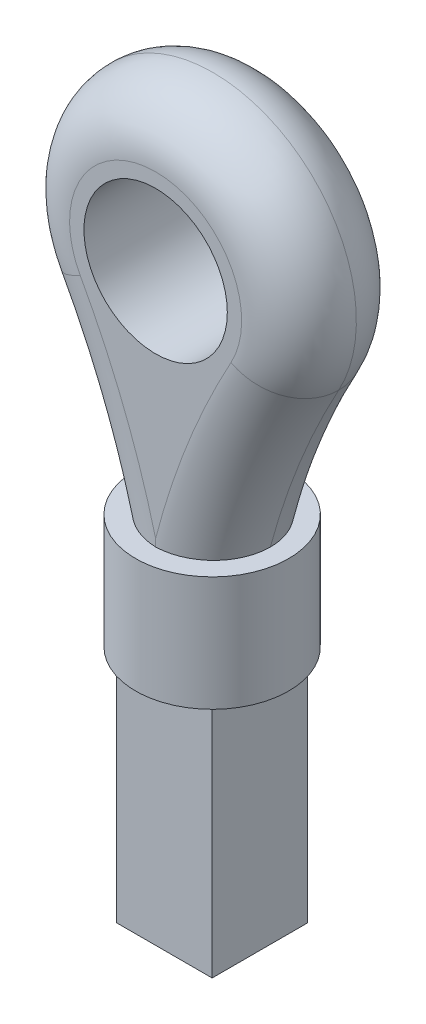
SolidWorks part; units mm, degrees
ref_plane "Front" through (0, 0, 0) normal (0, 0, 1) x (1, 0, 0)
ref_plane "Top" through (0, 0, 0) normal (0, 1, 0) x (1, 0, 0)
ref_plane "Right" through (0, 0, 0) normal (1, 0, 0) x (0, 0, -1)
sketch "Sketch1" plane through (0, 0, 0) normal (0, 0, 1) x (1, 0, 0)
  line L0 (-6, -25) -> (6, -25)
  line L1 (0, -25) -> (0, 28.6651) construction
  arc A0 (13.1472, -7.2215) -> (-13.1472, -7.2215) centre (0, 0) ccw
  circle A1 centre (0, 0) radius 7.5
  arc A2 (-13.1472, -7.2215) -> (-6, -25) centre (-83.2658, -45.7362) cw
  arc A3 (13.1472, -7.2215) -> (6, -25) centre (83.2658, -45.7362) ccw
  dimension "D2" = 15
  dimension "D3" = 15
  dimension "D5" = 80
  dimension "D1" = 12
  dimension "D4" = 25
extrude "Boss-Extrude1" add sketch "Sketch1" along normal blind 12
fillet "Fillet1" radius 6 6 edges at (-9.0394, -15.896, 0) (0, 15, 0) (-9.0394, -15.896, 12) (0, 15, 12) (9.0394, -15.896, 0) (9.0394, -15.896, 12)
sketch "Sketch2" plane through (0, -25, 0) normal (0, -1, 0) x (1, 0, 0)
  circle A0 centre (0, 6.0869) radius 8.0078
extrude "Boss-Extrude2" add sketch "Sketch2" along normal blind 12
sketch "Sketch3" plane through (0, -37, 0) normal (0, -1, 0) x (1, 0, 0)
  line L1 (-5, 11.0869) -> (5, 11.0869)
  line L2 (-5, 11.0869) -> (-5, 1.0869)
  line L3 (-5, 1.0869) -> (5, 1.0869)
  line L4 (5, 11.0869) -> (5, 1.0869)
  line L5 (-5, 11.0869) -> (5, 1.0869) construction
  line L6 (-5, 1.0869) -> (5, 11.0869) construction
  point P0 (0, 6.0869)
  dimension "D1" = 10
  dimension "D2" = 10
extrude "Boss-Extrude3" add sketch "Sketch3" along normal blind 25
